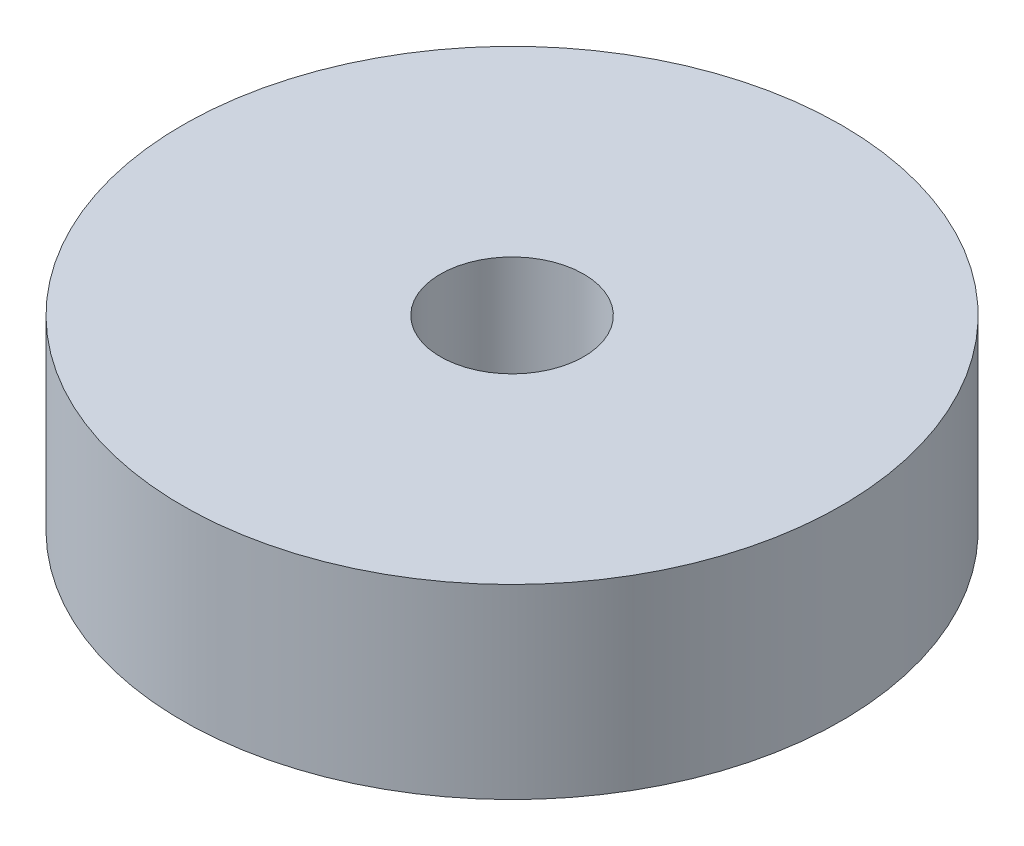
SolidWorks part; units mm, degrees
ref_plane "Front Plane" through (0, 0, 0) normal (0, 0, 1) x (1, 0, 0)
ref_plane "Top Plane" through (0, 0, 0) normal (0, 1, 0) x (1, 0, 0)
ref_plane "Right Plane" through (0, 0, 0) normal (1, 0, 0) x (0, 0, -1)
sketch "Sketch1" plane through (0, 0, 0) normal (0, 1, 0) x (1, 0, 0)
  circle A0 centre (0, 0) radius 10
  circle A1 centre (0, 0) radius 46
extrude "Boss-Extrude1" add sketch "Sketch1" along normal blind 26
